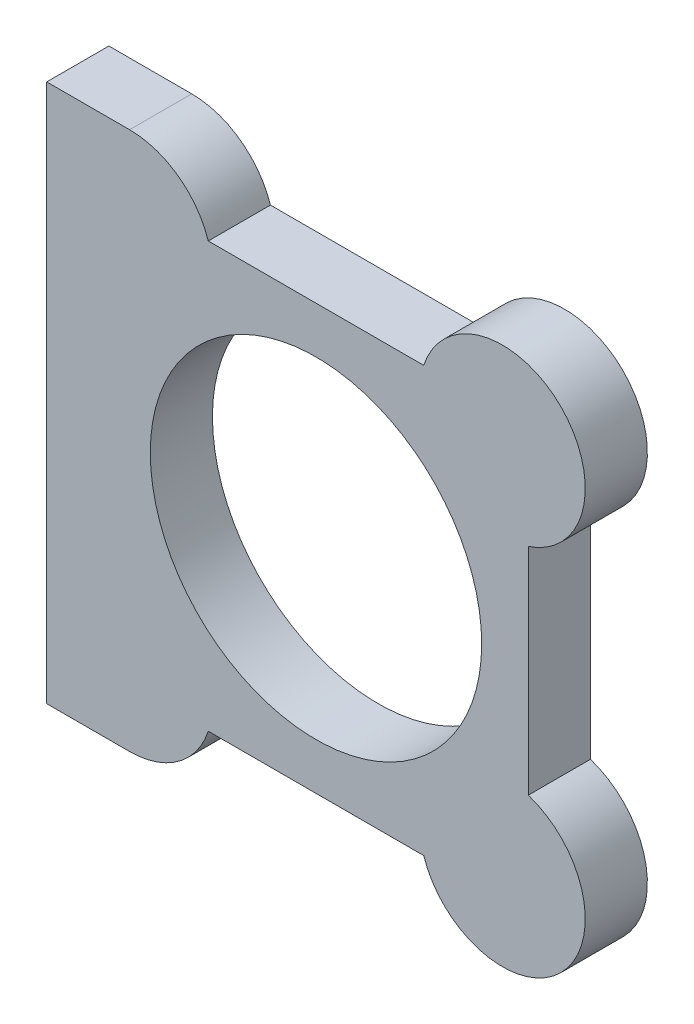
SolidWorks part; units mm, degrees
ref_plane "Plan de face" through (0, 0, 0) normal (0, 0, 1) x (1, 0, 0)
ref_plane "Plan de dessus" through (0, 0, 0) normal (0, 1, 0) x (1, 0, 0)
ref_plane "Plan de droite" through (0, 0, 0) normal (1, 0, 0) x (0, 0, -1)
sketch "Esquisse1" plane through (0, 0, 0) normal (0, 0, 1) x (1, 0, 0)
  line L1 (0, 0) -> (52, 0)
  line L2 (0, 0) -> (0, 52)
  line L3 (0, 52) -> (52, 52)
  line L4 (52, 0) -> (52, 52)
  dimension "D1" = 52
  dimension "D2" = 52
extrude "Boss.-Extru.1" add sketch "Esquisse1" along normal blind 6
sketch "Esquisse2" plane through (0, 0, 6) normal (0, 0, 1) x (1, 0, 0)
  line L0 (52, 52) -> (0, 52) construction
  line L1 (52, 0) -> (52, 52) construction
  line L2 (0, 0) -> (52, 0) construction
  line L3 (0, 52) -> (0, 0) construction
  line L4 (15.6007, 46.496) -> (36.3993, 46.496)
  line L5 (15.5993, 5.5) -> (36.4007, 5.5)
  line L6 (46.5, 15.5993) -> (46.5, 36.4007)
  line L11 (8, 52) -> (0, 52)
  line L12 (0, 52) -> (0, 0)
  line L13 (0, 0) -> (8, 0)
  arc A0 (46.5, 36.4007) -> (36.3993, 46.496) centre (44, 44) ccw
  arc A1 (36.4007, 5.5) -> (46.5, 15.5993) centre (44, 8) ccw
  arc A2 (15.6007, 46.496) -> (8, 52) centre (8, 44) ccw
  arc A3 (8, 0) -> (15.5993, 5.5) centre (8, 8) ccw
  circle A5 centre (26, 26) radius 16
  dimension "D1" = 16
  dimension "D2" = 16
  dimension "D3" = 16
  dimension "D4" = 16
  dimension "D8" = 32
  dimension "D10" = 26
  dimension "D5" = 2.496
  dimension "D6" = 2.5
  dimension "D7" = 2.5
  dimension "D9" = 26
extrude "Enlèv. mat.-Extru.1" cut sketch "Esquisse2" against normal through all
